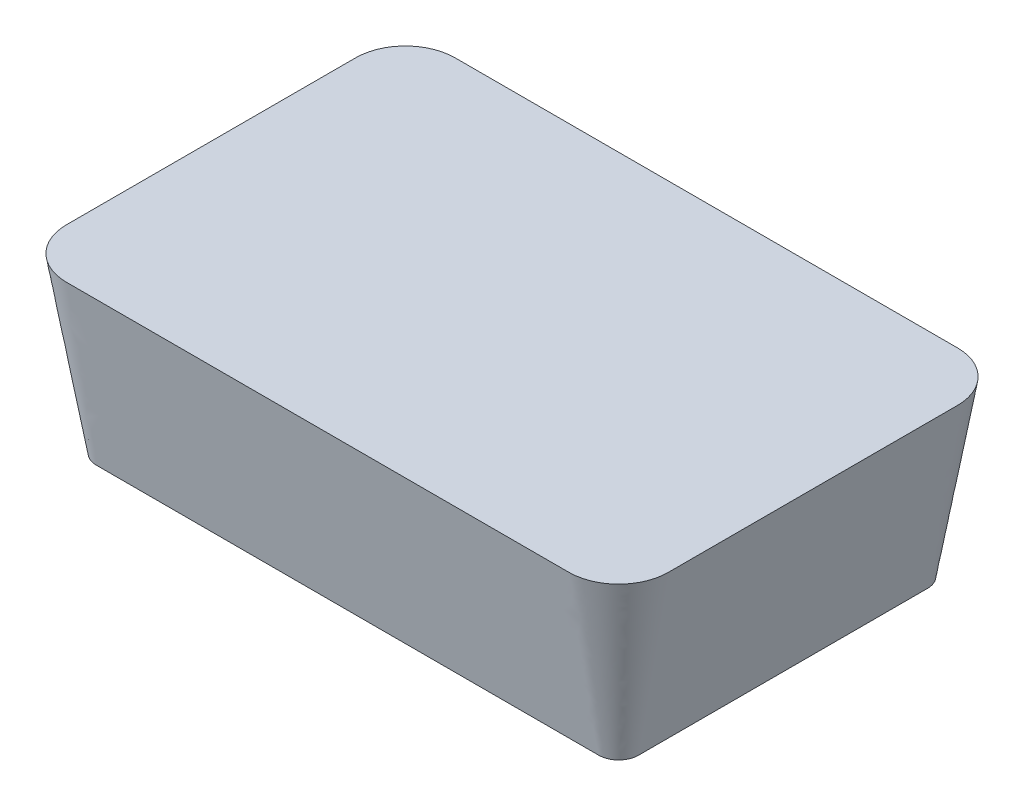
SolidWorks part; units mm, degrees
ref_plane "Front" through (0, 0, 0) normal (0, 0, 1) x (1, 0, 0)
ref_plane "Top" through (0, 0, 0) normal (0, 1, 0) x (1, 0, 0)
ref_plane "Right" through (0, 0, 0) normal (1, 0, 0) x (0, 0, -1)
sketch "Sketch1" plane through (0, 0, 0) normal (0, 1, 0) x (1, 0, 0)
  line L1 (160.02, -104.775) -> (-160.02, -104.775)
  line L2 (172.72, -92.075) -> (172.72, 92.075)
  line L3 (160.02, 104.775) -> (-160.02, 104.775)
  line L4 (-172.72, -92.075) -> (-172.72, 92.075)
  line L5 (172.72, -104.775) -> (-172.72, 104.775) construction
  line L6 (172.72, 104.775) -> (-172.72, -104.775) construction
  arc A0 (172.72, 92.075) -> (160.02, 104.775) centre (160.02, 92.075) ccw
  arc A1 (160.02, -104.775) -> (172.72, -92.075) centre (160.02, -92.075) ccw
  arc A2 (-160.02, -104.775) -> (-172.72, -92.075) centre (-160.02, -92.075) cw
  arc A3 (-160.02, 104.775) -> (-172.72, 92.075) centre (-160.02, 92.075) ccw
  point P0 (0, 0)
  dimension "D3" = 12.7
  dimension "D1" = 209.55
  dimension "D2" = 345.44
ref_plane "Plane1" through (0, 110.49, 0) normal (0, 1, 0) x (1, 0, 0)
sketch "Sketch2" plane through (0, 110.49, 0) normal (0, 1, 0) x (1, 0, 0)
  line L8 (191.77, -92.075) -> (191.77, 92.075)
  line L9 (160.02, 123.825) -> (-160.02, 123.825)
  line L10 (-191.77, 92.075) -> (-191.77, -92.075)
  line L11 (-160.02, -123.825) -> (160.02, -123.825)
  line L12 (191.77, -92.075) -> (191.77, 92.075)
  line L13 (160.02, 123.825) -> (-160.02, 123.825)
  line L14 (-191.77, 92.075) -> (-191.77, -92.075)
  line L15 (-160.02, -123.825) -> (160.02, -123.825)
  arc A8 (191.77, 92.075) -> (160.02, 123.825) centre (160.02, 92.075) ccw
  arc A9 (-160.02, 123.825) -> (-191.77, 92.075) centre (-160.02, 92.075) ccw
  arc A10 (-191.77, -92.075) -> (-160.02, -123.825) centre (-160.02, -92.075) ccw
  arc A11 (160.02, -123.825) -> (191.77, -92.075) centre (160.02, -92.075) ccw
  arc A12 (191.77, 92.075) -> (160.02, 123.825) centre (160.02, 92.075) ccw
  arc A13 (-160.02, 123.825) -> (-191.77, 92.075) centre (-160.02, 92.075) ccw
  arc A14 (-191.77, -92.075) -> (-160.02, -123.825) centre (-160.02, -92.075) ccw
  arc A15 (160.02, -123.825) -> (191.77, -92.075) centre (160.02, -92.075) ccw
  dimension "D1" = 19.05
loft "Loft3" add profiles "Sketch2", "Sketch1"
